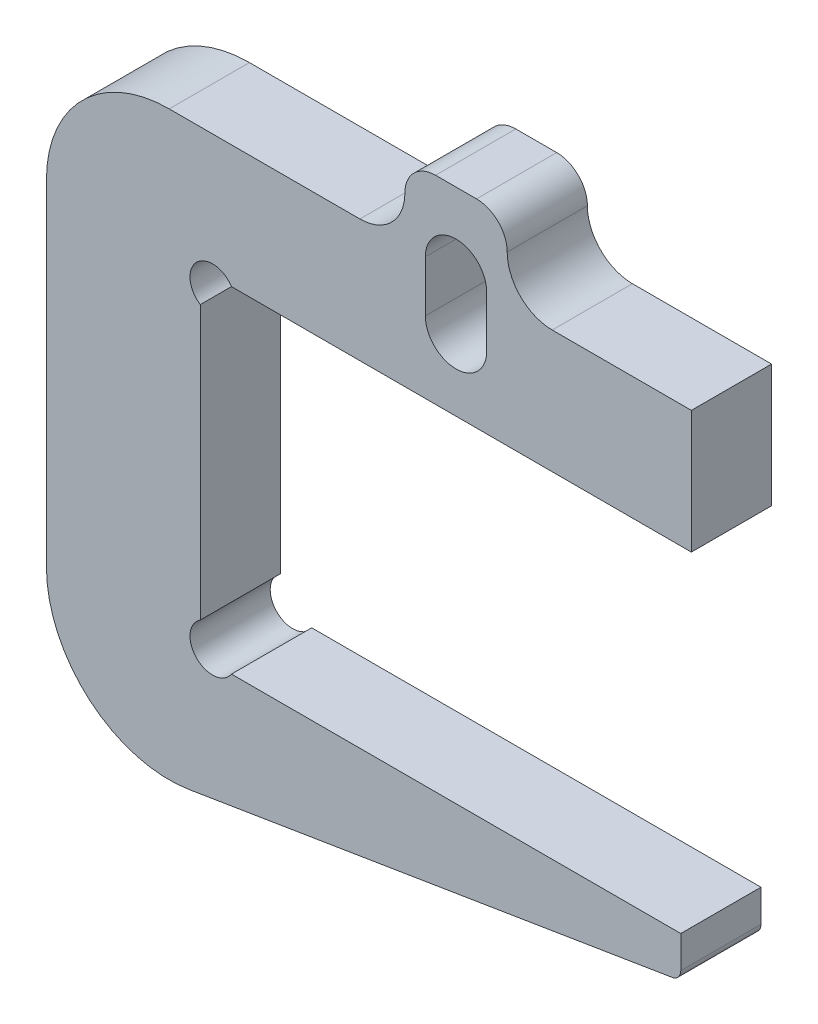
SolidWorks part; units mm, degrees
ref_plane "Face" through (0, 0, 0) normal (0, 0, 1) x (1, 0, 0)
ref_plane "Dessus" through (0, 0, 0) normal (0, 1, 0) x (1, 0, 0)
ref_plane "Droite" through (0, 0, 0) normal (1, 0, 0) x (0, 0, -1)
sketch "Esquisse1" plane through (0, 0, 0) normal (0, 0, 1) x (1, 0, 0)
  line L0 (575, -300) -> (-548.7813, -300)
  line L1 (-625, -376.2187) -> (-625, -1043.7813)
  line L2 (-75, 0) -> (-75, -125)
  line L3 (-548.7813, -1120) -> (549.118, -1120)
  line L4 (75, 0) -> (75, -125)
  line L5 (549.118, -1120) -> (549.118, -1198.7487)
  line L6 (528.1441, -1223.4224) -> (-652.5687, -1416.0842)
  line L7 (-1000.882, -1120) -> (-1000.882, -300)
  line L8 (-700.882, 0) -> (-235, 0)
  line L9 (-235, 110) -> (235, 110) construction
  line L10 (-50, 185) -> (50, 185)
  line L11 (-625, -710) -> (1121.591, -710) construction
  line L12 (235, 0) -> (575, 0)
  line L13 (575, 0) -> (575, -300)
  line L14 (0, 185) -> (0, -304.7531) construction
  arc A0 (75, 0) -> (-75, 0) centre (0, 0) ccw
  arc A1 (-75, -125) -> (75, -125) centre (0, -125) ccw
  arc A2 (-652.5687, -1416.0842) -> (-1000.882, -1120) centre (-700.882, -1120) cw
  arc A3 (-1000.882, -300) -> (-700.882, 0) centre (-700.882, -300) cw
  arc A4 (549.118, -1198.7487) -> (528.1441, -1223.4224) centre (524.118, -1198.7487) cw
  arc A5 (-235, 0) -> (-125, 110) centre (-235, 110) ccw
  arc A6 (50, 185) -> (125, 110) centre (50, 110) cw
  arc A7 (-125, 110) -> (-50, 185) centre (-50, 110) cw
  arc A8 (125, 110) -> (235, 0) centre (235, 110) ccw
  arc A9 (-548.7813, -300) -> (-625, -376.2187) centre (-595, -330) ccw
  arc A10 (-625, -1043.7813) -> (-548.7813, -1120) centre (-595, -1090) ccw
  point P25 (549.118, -1220)
  dimension "D1" = 75
  dimension "D10" = 300
  dimension "D11" = 110.2029
  dimension "D12" = 25
  dimension "D13" = 110
  dimension "D14" = 380
  dimension "D15" = 625
  dimension "D2" = 125
  dimension "D3" = 375.882
  dimension "D4" = 1200
  dimension "D5" = 250
  dimension "D6" = 100
  dimension "D7" = 1250
  dimension "D8" = 820
  dimension "D9" = 300
  dimension "D16" = 30
extrude "Boss.-Extru.1" add sketch "Esquisse1" along normal mid plane 195.9694
